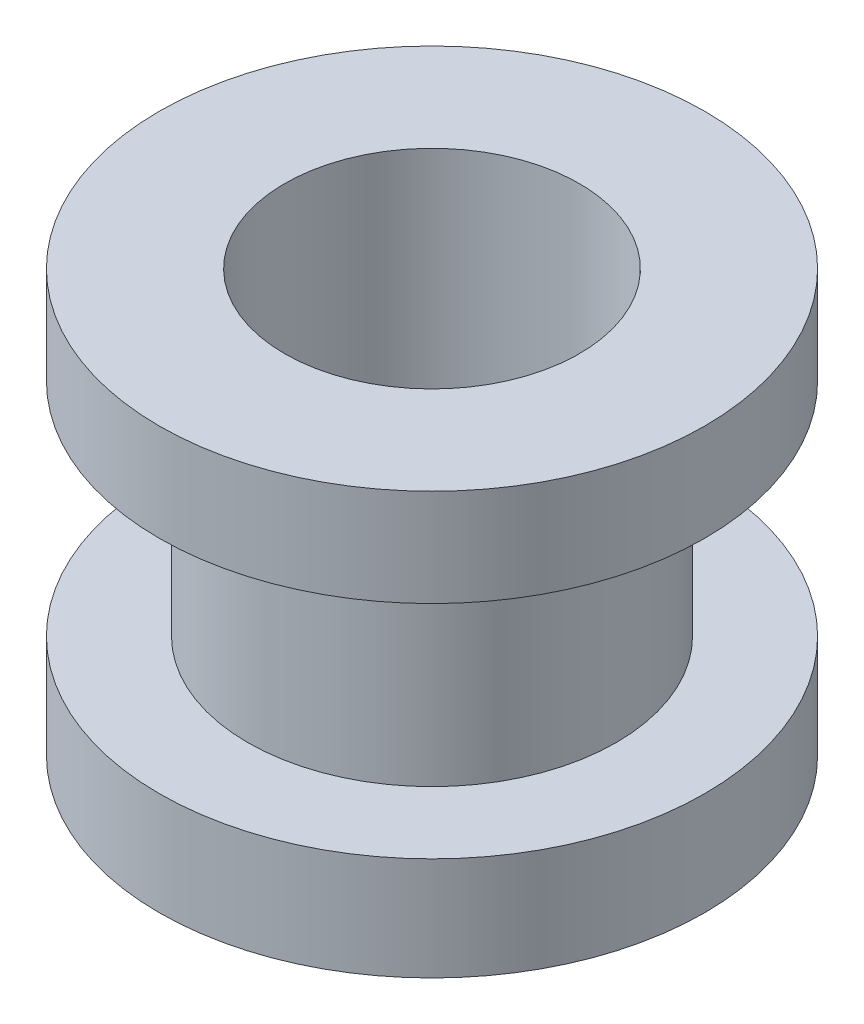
SolidWorks part; units mm, degrees
ref_plane "Front Plane" through (0, 0, 0) normal (0, 0, 1) x (1, 0, 0)
ref_plane "Top Plane" through (0, 0, 0) normal (0, 1, 0) x (1, 0, 0)
ref_plane "Right Plane" through (0, 0, 0) normal (1, 0, 0) x (0, 0, -1)
sketch "Sketch1" plane through (0, 0, 0) normal (0, 1, 0) x (1, 0, 0)
  circle A0 centre (0, 0) radius 4.699
  dimension "D1" = 9.398
extrude "Extrude1" add sketch "Sketch1" along normal blind 1.6764
sketch "Sketch2" plane through (0, 0, 0) normal (0, 1, 0) x (1, 0, 0)
  circle A0 centre (0, 0) radius 3.175
  dimension "D1" = 6.35
extrude "Extrude2" add sketch "Sketch2" against normal blind 3.81
sketch "Sketch3" plane through (0, -3.81, 0) normal (0, -1, 0) x (1, 0, 0)
  circle A0 centre (0, 0) radius 4.699
  dimension "D1" = 9.398
extrude "Extrude3" add sketch "Sketch3" along normal blind 1.778
sketch "Sketch4" plane through (0, 0, 0) normal (0, 1, 0) x (1, 0, 0)
  circle A0 centre (0, 0) radius 2.54
  dimension "D1" = 5.08
extrude "Cut-Extrude1" cut sketch "Sketch4" against normal through all and the other way through all
